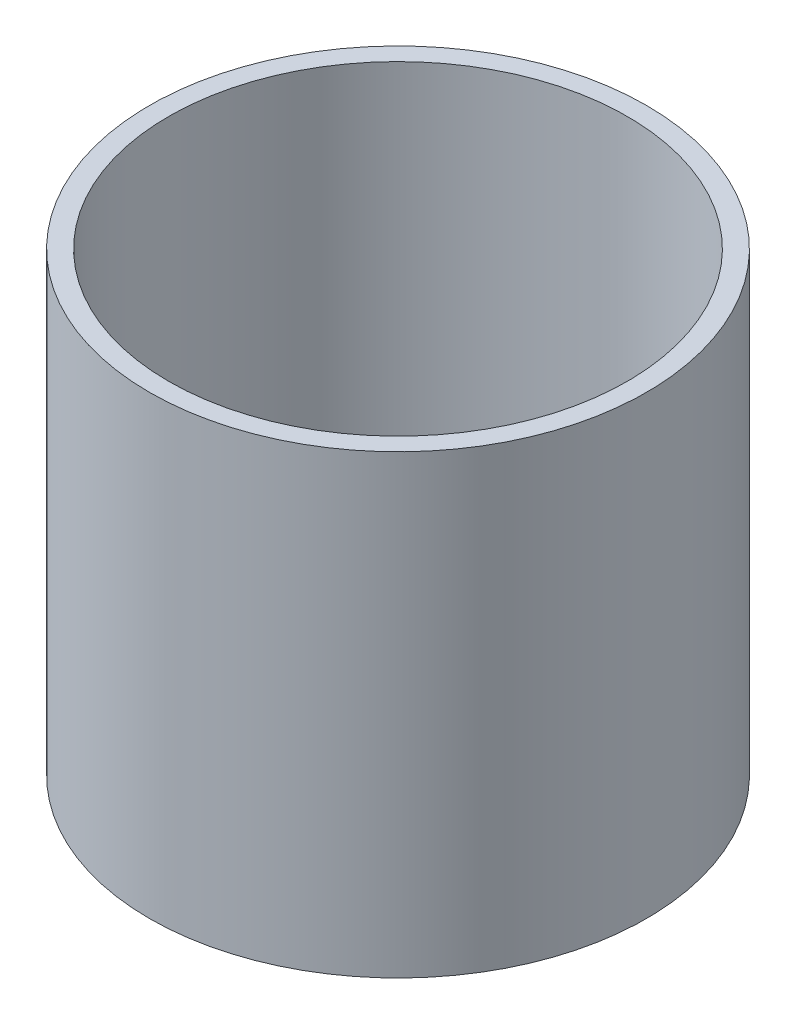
SolidWorks part; units mm, degrees
ref_plane "Plane1" through (0, 0, 0) normal (0, 0, 1) x (1, 0, 0)
ref_plane "Plane2" through (0, 0, 0) normal (0, 1, 0) x (1, 0, 0)
ref_plane "Plane3" through (0, 0, 0) normal (1, 0, 0) x (0, 0, -1)
sketch "Sketch2" plane through (0, 0, 0) normal (0, 0, 1) x (1, 0, 0)
  line L0 (0, 85.852) -> (0, -97.028) construction
  line L1 (76.2, -75.692) -> (76.2, 75.6944)
  line L2 (76.2, 75.6944) -> (82.55, 75.6944)
  line L3 (82.55, 75.6944) -> (82.55, -75.692)
  line L4 (-35.56, 0) -> (114.808, 0) construction
  line L9 (82.55, -75.692) -> (76.2, -75.692)
  dimension "D1" = 6.35
revolve "Base-Revolve" add sketch "Sketch2" angle 360 about L0
sketch "Sketch6" [suppressed] plane through (0, 0, 0) normal (0, 0, 1) x (1, 0, 0)
  line L0 (-87.63, 58.4224) -> (87.63, 58.4224) construction
  line L1 (-87.63, 58.4224) -> (87.63, 58.4224)
sketch "Sketch7" [suppressed] plane through (0, 0, 0) normal (0, 0, 1) x (1, 0, 0)
  line L0 (87.63, -58.42) -> (-87.63, -58.42) construction
  line L1 (87.63, -58.42) -> (-87.63, -58.42)
